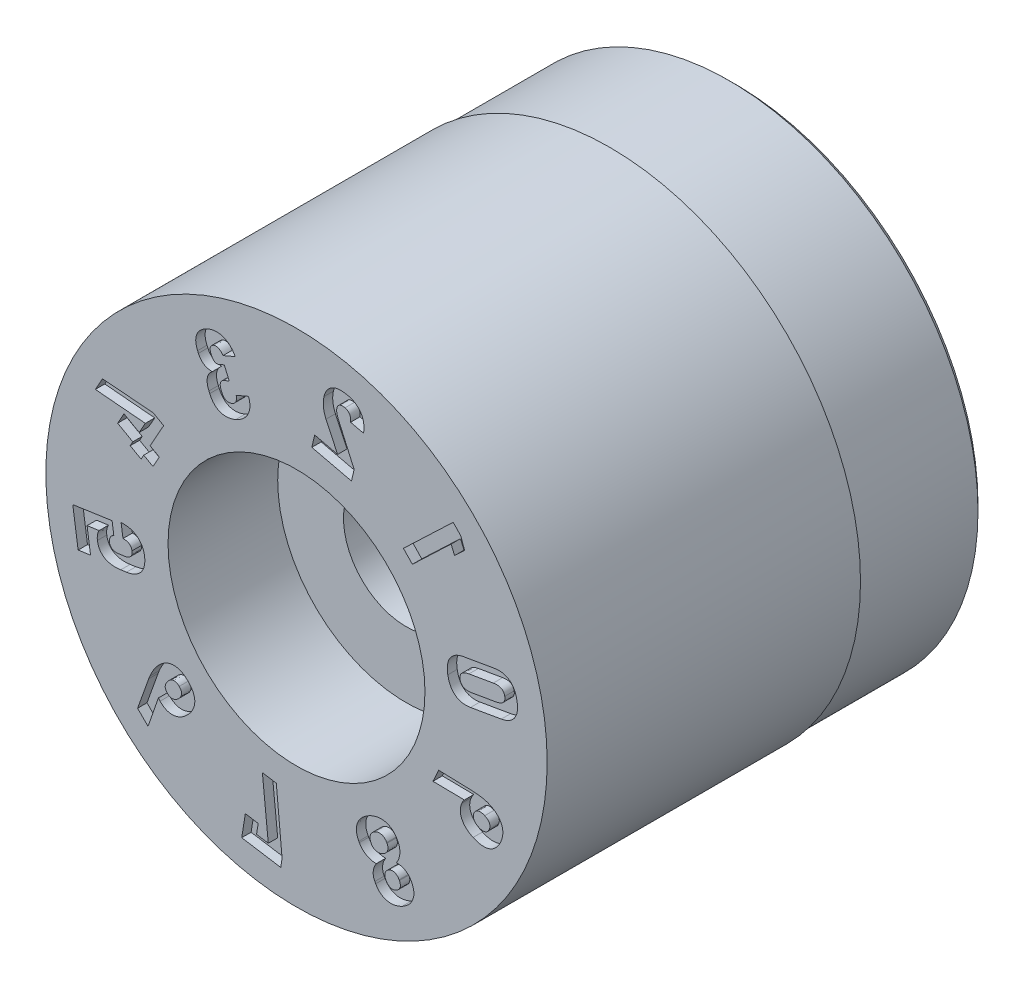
SolidWorks part; units mm, degrees
ref_plane "Front Plane" through (0, 0, 0) normal (0, 0, 1) x (1, 0, 0)
ref_plane "Top Plane" through (0, 0, 0) normal (0, 1, 0) x (1, 0, 0)
ref_plane "Right Plane" through (0, 0, 0) normal (1, 0, 0) x (0, 0, -1)
sketch "Sketch1" plane through (0, 0, 0) normal (1, 0, 0) x (0, 0, -1)
  line L2 (0, 8) -> (0, 4.1)
  line L3 (13.75, 8) -> (0, 8)
  line L4 (-3.7979, 0) -> (49996.2021, 0) construction
  line L8 (14, 2) -> (3.5, 2)
  line L9 (3.5, 4.1) -> (3.5, 2)
  line L10 (3.5, 4.1) -> (0, 4.1)
  line L12 (14, 2) -> (14, 7.75)
  line L16 (14, 7.75) -> (13.75, 8)
  dimension "D1" = 14
  dimension "D2" = 45
  dimension "D3" = 0.25
  dimension "D4" = 16
  dimension "D5" = 8.2
  dimension "D6" = 3.5
  dimension "D7" = 4
revolve "Revolve1" add sketch "Sketch1" angle 360 about L4
sketch "Sketch4" plane through (0, 0, 0) normal (1, 0, 0) x (0, 0, -1)
  line L0 (0, 0) -> (50000, 0) construction
  line L1 (14, -7.75) -> (14, 7.75) construction
  line L2 (10, 8.935) -> (14, 8.935)
  line L3 (10, 8.935) -> (10, 7.935)
  line L4 (10, 7.935) -> (14, 7.935)
  line L5 (14, 8.935) -> (14, 7.935)
  line L6 (13.75, 8) -> (0, 8) construction
  line L9 (0, 8.8) -> (0, -8.8) construction
  dimension "D1" = 1
  dimension "D2" = 0.065
  dimension "D3" = 10
revolve "Cut-Revolve1" cut sketch "Sketch4" angle 360 about L0
sketch "Sketch6" plane through (0, 0, 0) normal (0, 0, 1) x (1, 0, 0)
  line L0 (5.5542, 0.2955) -> (6.5363, 0.4655)
  line L1 (6.3127, 1.758) -> (5.3306, 1.588)
  line L2 (5.5052, 1.199) -> (6.2794, 1.3326)
  line L3 (6.3618, 0.854) -> (5.5877, 0.7204)
  line L4 (3.4124, 3.6235) -> (3.6977, 3.3237)
  line L5 (3.6977, 3.3237) -> (4.9346, 4.5019)
  line L6 (4.9346, 4.5019) -> (5.0458, 4.2393)
  line L7 (5.0458, 4.2393) -> (5.3635, 4.5421)
  line L8 (5.3635, 4.5421) -> (5.2444, 4.8814)
  line L9 (5.2444, 4.8814) -> (5.001, 5.137)
  line L10 (5.001, 5.137) -> (3.4124, 3.6235)
  line L11 (1.8398, 5.0165) -> (1.3333, 6.1553)
  line L12 (1.29, 6.4407) -> (1.2908, 6.4433)
  line L13 (1.7261, 6.2661) -> (1.7259, 6.2647)
  line L14 (1.7259, 6.2647) -> (2.1393, 6.1671)
  line L15 (2.1393, 6.1671) -> (2.1395, 6.1686)
  line L16 (0.8786, 6.5533) -> (0.8782, 6.5515)
  line L17 (0.9418, 5.9571) -> (1.3116, 5.1681)
  line L18 (1.3116, 5.1681) -> (0.5802, 5.3405)
  line L19 (0.5802, 5.3405) -> (0.4886, 4.9521)
  line L20 (0.4886, 4.9521) -> (1.7539, 4.6535)
  line L21 (1.7539, 4.6535) -> (1.8398, 5.0165)
  line L22 (-1.5333, 5.3519) -> (-1.9256, 5.1828)
  line L23 (-2.3792, 5.0286) -> (-2.3996, 5.0756)
  line L24 (-2.3182, 5.3954) -> (-2.1481, 5.469)
  line L25 (-2.1481, 5.469) -> (-2.3059, 5.8346)
  line L26 (-2.3059, 5.8346) -> (-2.476, 5.761)
  line L27 (-2.7166, 5.9039) -> (-2.7316, 5.939)
  line L28 (-2.3462, 6.0707) -> (-1.9551, 6.2391)
  line L29 (-3.1565, 5.8021) -> (-3.1304, 5.741)
  line L30 (-2.7943, 4.8707) -> (-2.7682, 4.8096)
  line L31 (-4.571, 3.3742) -> (-6.1899, 3.5076)
  line L32 (-6.1899, 3.5076) -> (-6.4194, 3.0994)
  line L33 (-6.4194, 3.0994) -> (-4.8252, 2.9593)
  line L34 (-4.8252, 2.9593) -> (-5.0211, 2.6104)
  line L35 (-5.308, 2.0993) -> (-4.9604, 1.9038)
  line L36 (-4.9604, 1.9038) -> (-4.876, 2.0542)
  line L37 (-4.2394, 3.1878) -> (-4.571, 3.3742)
  line L38 (-5.5057, 2.8825) -> (-5.7084, 2.5216)
  line L39 (-5.7084, 2.5216) -> (-5.2237, 2.2495)
  line L40 (-4.5808, 1.8885) -> (-4.3782, 2.2494)
  line L41 (-4.3782, 2.2494) -> (-4.6733, 2.4151)
  line L42 (-5.5963, -0.1705) -> (-5.5982, -0.1706)
  line L43 (-5.5982, -0.1706) -> (-5.5385, -0.5815)
  line L44 (-5.5385, -0.5815) -> (-5.5366, -0.5814)
  line L45 (-5.4859, -1.0436) -> (-5.6688, -1.0705)
  line L46 (-5.8301, -0.6456) -> (-5.8863, -0.2618)
  line L47 (-5.8863, -0.2618) -> (-7.1402, -0.4449)
  line L48 (-7.1402, -0.4449) -> (-6.9693, -1.6158)
  line L49 (-6.9693, -1.6158) -> (-6.5734, -1.5578)
  line L50 (-6.5734, -1.5578) -> (-6.6841, -0.7976)
  line L51 (-6.6841, -0.7976) -> (-6.2989, -0.7414)
  line L52 (-5.609, -1.4818) -> (-5.4261, -1.4549)
  line L53 (-4.39, -3.5025) -> (-4.3913, -3.5038)
  line L54 (-4.716, -4.0466) -> (-5.0719, -5.0388)
  line L55 (-5.0719, -5.0388) -> (-4.7385, -5.372)
  line L56 (-4.7385, -5.372) -> (-4.4072, -4.4216)
  line L58 (-3.4799, -4.4248) -> (-3.4786, -4.4235)
  line L59 (-3.7555, -4.1103) -> (-3.7568, -4.1116)
  line L60 (-4.0818, -3.7842) -> (-4.0809, -3.7833)
  line L61 (-0.4596, -6.8815) -> (-0.6441, -4.8972)
  line L62 (-0.6441, -4.8972) -> (-1.0896, -4.8259)
  line L63 (-1.0896, -4.8259) -> (-0.9003, -6.6854)
  line L64 (-0.9003, -6.6854) -> (-1.2749, -6.6254)
  line L65 (-1.2749, -6.6254) -> (-1.2226, -6.2973)
  line L66 (-1.2226, -6.2973) -> (-1.6332, -6.2317)
  line L67 (-1.6332, -6.2317) -> (-1.7486, -6.9557)
  line L68 (-1.7486, -6.9557) -> (-0.503, -7.1546)
  line L69 (-0.503, -7.1546) -> (-0.4596, -6.8815)
  line L70 (1.9882, -5.1834) -> (2.0053, -5.2152)
  line L71 (2.4996, -6.04) -> (2.5267, -6.0908)
  line L72 (3.6739, -5.4748) -> (3.6468, -5.424)
  line L73 (3.2325, -4.5565) -> (3.2154, -4.5247)
  line L74 (2.8789, -4.7738) -> (2.8888, -4.7922)
  line L75 (2.3907, -5.0578) -> (2.3799, -5.0383)
  line L76 (3.2744, -5.6056) -> (3.2842, -5.624)
  line L77 (2.8655, -5.8471) -> (2.855, -5.8272)
  line L79 (5.6352, -3.2556) -> (5.6364, -3.2563)
  line L80 (6.1605, -2.0849) -> (6.1589, -2.0845)
  line L81 (5.5532, -1.9782) -> (4.536, -1.9464)
  line L82 (4.536, -1.9464) -> (4.3553, -2.3445)
  line L83 (4.3553, -2.3445) -> (5.359, -2.3585)
  line L84 (6.0058, -2.4686) -> (6.0077, -2.4693)
  line L85 (5.8169, -2.8846) -> (5.8157, -2.8838)
  line L86 (-5.0211, 2.6104) -> (-5.5057, 2.8825)
  line L87 (-4.6733, 2.4151) -> (-4.2394, 3.1878)
  line L88 (-4.876, 2.0542) -> (-4.5808, 1.8885)
  line L89 (-5.2237, 2.2495) -> (-5.308, 2.0993)
  spline S0 degree 3 poles (4.8291, 0.8358) (4.8382, 0.7861) (4.8543, 0.714) (4.8875, 0.6241) (4.9167, 0.5646) (4.949, 0.5101) (4.9867, 0.4617) (5.0283, 0.4186) (5.0742, 0.3815) (5.1237, 0.3501) (5.1763, 0.3245) (5.2321, 0.305) (5.2909, 0.2914) (5.3526, 0.2834) (5.441, 0.2804) (5.5086, 0.2878) (5.5542, 0.2955) knots 0 0 0 0 0.147217 0.214712 0.278663 0.339975 0.399046 0.456919 0.51397 0.570756 0.627411 0.684057 0.742633 0.802806 0.865145 1 1 1 1
  spline S1 degree 3 poles (6.5363, 0.4655) (6.5824, 0.4729) (6.6486, 0.4901) (6.732, 0.5219) (6.7875, 0.5506) (6.8386, 0.583) (6.8843, 0.6204) (6.925, 0.6625) (6.961, 0.7086) (6.9911, 0.7593) (7.0157, 0.8136) (7.0347, 0.8717) (7.0474, 0.9338) (7.0533, 0.9996) (7.0557, 1.0951) (7.0469, 1.1683) (7.0382, 1.2178) knots 0 0 0 0 0.135673 0.198806 0.259377 0.317444 0.374709 0.430962 0.487709 0.544607 0.602164 0.661103 0.722235 0.786287 0.853376 1 1 1 1
  spline S2 degree 3 poles (7.0382, 1.2178) (7.0298, 1.2675) (7.0122, 1.3391) (6.98, 1.4291) (6.9514, 1.4888) (6.9188, 1.5431) (6.8817, 1.5918) (6.8405, 1.635) (6.795, 1.6722) (6.7461, 1.704) (6.6935, 1.7292) (6.6381, 1.7493) (6.579, 1.7628) (6.5169, 1.7706) (6.4274, 1.7729) (6.3589, 1.7666) (6.3127, 1.758) knots 0 0 0 0 0.146552 0.213952 0.277771 0.338999 0.397857 0.455472 0.512222 0.568665 0.624628 0.681472 0.739969 0.800447 0.86351 1 1 1 1
  spline S3 degree 3 poles (5.3306, 1.588) (5.2846, 1.5805) (5.2183, 1.5633) (5.135, 1.5316) (5.0794, 1.5029) (5.0283, 1.4705) (4.9826, 1.4331) (4.9419, 1.3909) (4.9059, 1.3449) (4.8758, 1.2942) (4.8512, 1.2398) (4.8323, 1.1815) (4.8205, 1.1194) (4.8132, 1.0537) (4.8126, 0.9583) (4.8202, 0.8852) (4.8291, 0.8358) knots 0 0 0 0 0.135708 0.198857 0.259443 0.317526 0.374806 0.431073 0.487835 0.544747 0.60232 0.661617 0.722541 0.786404 0.853765 1 1 1 1
  spline S4 degree 3 poles (5.2216, 0.9036) (5.2188, 0.9228) (5.2153, 0.9514) (5.2186, 0.9884) (5.2233, 1.014) (5.2314, 1.0379) (5.2428, 1.0601) (5.2563, 1.0811) (5.2799, 1.1068) (5.3168, 1.1351) (5.3926, 1.1747) (5.4587, 1.1908) (5.5052, 1.199) knots 0 0 0 0 0.125469 0.183502 0.238196 0.292202 0.345199 0.39803 0.452614 0.568042 0.695193 1 1 1 1
  spline S5 degree 3 poles (6.2794, 1.3326) (6.326, 1.3401) (6.3937, 1.3477) (6.4784, 1.336) (6.5226, 1.3218) (6.5534, 1.3057) (6.5734, 1.2906) (6.5917, 1.2737) (6.6074, 1.2538) (6.6205, 1.2312) (6.6361, 1.1974) (6.643, 1.1695) (6.6462, 1.1502) knots 0 0 0 0 0.304769 0.431914 0.546788 0.601175 0.654439 0.70726 0.761007 0.816749 0.874563 1 1 1 1
  spline S6 degree 3 poles (6.6462, 1.1502) (6.649, 1.131) (6.6525, 1.1024) (6.6492, 1.0652) (6.6444, 1.0395) (6.6358, 1.0157) (6.6246, 0.9934) (6.6106, 0.9725) (6.5871, 0.9467) (6.5504, 0.9179) (6.4744, 0.8784) (6.4084, 0.8622) (6.3618, 0.854) knots 0 0 0 0 0.125263 0.1832 0.239119 0.292289 0.345198 0.398713 0.453207 0.568753 0.695695 1 1 1 1
  spline S7 degree 3 poles (5.5877, 0.7204) (5.5412, 0.7127) (5.4737, 0.7057) (5.389, 0.717) (5.3449, 0.7318) (5.314, 0.748) (5.2939, 0.7628) (5.2761, 0.7802) (5.2603, 0.8) (5.2473, 0.8226) (5.2317, 0.8564) (5.2248, 0.8843) (5.2216, 0.9036) knots 0 0 0 0 0.304087 0.431327 0.546883 0.601309 0.654613 0.707043 0.76083 0.816614 0.87447 1 1 1 1
  spline S8 degree 3 poles (1.3333, 6.1553) (1.3113, 6.2033) (1.292, 6.2662) (1.2829, 6.3424) (1.2819, 6.3874) (1.2853, 6.42) (1.29, 6.4407) knots 0 0 0 0 0.539922 0.665878 0.783523 1 1 1 1
  spline S9 degree 3 poles (1.2908, 6.4433) (1.2971, 6.4692) (1.3113, 6.507) (1.3468, 6.5449) (1.378, 6.5655) (1.4146, 6.5786) (1.4721, 6.5877) (1.5176, 6.5804) (1.5481, 6.5737) knots 0 0 0 0 0.24666 0.358009 0.470272 0.586522 0.711155 1 1 1 1
  spline S10 degree 3 poles (1.5481, 6.5737) (1.579, 6.5668) (1.6226, 6.5483) (1.6696, 6.5077) (1.6962, 6.4702) (1.7156, 6.4268) (1.7317, 6.3585) (1.7307, 6.3035) (1.7261, 6.2661) knots 0 0 0 0 0.240293 0.353106 0.46857 0.587391 0.712468 1 1 1 1
  spline S11 degree 3 poles (2.1395, 6.1686) (2.1505, 6.2324) (2.1574, 6.3271) (2.1458, 6.4502) (2.1263, 6.5348) (2.0973, 6.6138) (2.0583, 6.6861) (2.0102, 6.7517) (1.9528, 6.8101) (1.8866, 6.8606) (1.7862, 6.9193) (1.7016, 6.9473) (1.6433, 6.9613) knots 0 0 0 0 0.18586 0.271097 0.354001 0.434451 0.512068 0.589213 0.667237 0.746341 0.827602 1 1 1 1
  spline S12 degree 3 poles (1.6433, 6.9613) (1.5812, 6.9762) (1.4889, 6.9901) (1.3685, 6.9891) (1.2867, 6.9781) (1.2107, 6.958) (1.1412, 6.9275) (1.0784, 6.8874) (1.0227, 6.8376) (0.9743, 6.7791) (0.9187, 6.6866) (0.8917, 6.608) (0.8786, 6.5533) knots 0 0 0 0 0.194839 0.283119 0.366442 0.445864 0.522265 0.597081 0.672165 0.748905 0.828025 1 1 1 1
  spline S13 degree 3 poles (0.8782, 6.5515) (0.8664, 6.5029) (0.8562, 6.4281) (0.8544, 6.327) (0.8599, 6.2503) (0.8713, 6.1741) (0.8938, 6.0747) (0.9208, 6.0032) (0.9418, 5.9571) knots 0 0 0 0 0.246312 0.370558 0.498065 0.625011 0.750111 1 1 1 1
  spline S14 degree 3 poles (-1.9364, 4.5089) (-1.8781, 4.5334) (-1.7967, 4.5789) (-1.7001, 4.6532) (-1.6385, 4.7144) (-1.5867, 4.7809) (-1.5446, 4.8521) (-1.5139, 4.9282) (-1.4933, 5.0083) (-1.4844, 5.0917) (-1.49, 5.2085) (-1.512, 5.2953) (-1.5333, 5.3519) knots 0 0 0 0 0.181401 0.266539 0.349449 0.430114 0.508126 0.586429 0.665043 0.744996 0.826374 1 1 1 1
  spline S15 degree 3 poles (-1.9256, 5.1828) (-1.9196, 5.1622) (-1.9147, 5.131) (-1.913, 5.0899) (-1.9161, 5.0612) (-1.9226, 5.0339) (-1.9326, 5.0085) (-1.9449, 4.9845) (-1.9609, 4.9626) (-1.9798, 4.9425) (-2.0097, 4.9184) (-2.035, 4.9034) (-2.0536, 4.896) knots 0 0 0 0 0.185865 0.271783 0.354772 0.435257 0.513511 0.590038 0.668281 0.74713 0.827936 1 1 1 1
  spline S16 degree 3 poles (-2.0536, 4.896) (-2.0859, 4.8819) (-2.136, 4.8673) (-2.2028, 4.8699) (-2.2474, 4.8827) (-2.2885, 4.905) (-2.3384, 4.9505) (-2.3649, 4.9959) (-2.3792, 5.0286) knots 0 0 0 0 0.266348 0.383344 0.497307 0.612195 0.731219 1 1 1 1
  spline S17 degree 3 poles (-2.3996, 5.0756) (-2.414, 5.1099) (-2.4314, 5.161) (-2.4356, 5.2292) (-2.4297, 5.2734) (-2.4153, 5.3134) (-2.3821, 5.3601) (-2.3453, 5.3843) (-2.3182, 5.3954) knots 0 0 0 0 0.300133 0.427472 0.545362 0.656146 0.76528 1 1 1 1
  spline S18 degree 3 poles (-2.476, 5.761) (-2.498, 5.7516) (-2.5337, 5.7435) (-2.5804, 5.7521) (-2.6129, 5.7673) (-2.6429, 5.7908) (-2.6827, 5.8337) (-2.7036, 5.875) (-2.7166, 5.9039) knots 0 0 0 0 0.228705 0.33556 0.446598 0.566693 0.696338 1 1 1 1
  spline S19 degree 3 poles (-2.7316, 5.939) (-2.7433, 5.9666) (-2.7572, 6.0085) (-2.7581, 6.0644) (-2.7512, 6.1011) (-2.7371, 6.1345) (-2.7061, 6.174) (-2.6733, 6.1948) (-2.6493, 6.2049) knots 0 0 0 0 0.286802 0.411384 0.527644 0.639553 0.752359 1 1 1 1
  spline S20 degree 3 poles (-2.6493, 6.2049) (-2.6327, 6.2118) (-2.6067, 6.2194) (-2.5709, 6.2217) (-2.544, 6.2196) (-2.5171, 6.2135) (-2.4906, 6.2038) (-2.4645, 6.1902) (-2.4388, 6.1733) (-2.414, 6.1528) (-2.381, 6.1201) (-2.3601, 6.0908) (-2.3462, 6.0707) knots 0 0 0 0 0.149222 0.221968 0.296835 0.371824 0.450058 0.530027 0.61556 0.703724 0.796659 1 1 1 1
  spline S21 degree 3 poles (-1.9551, 6.2391) (-1.9851, 6.2952) (-2.0375, 6.3731) (-2.1222, 6.4612) (-2.1894, 6.5158) (-2.2615, 6.5594) (-2.3362, 6.5934) (-2.4144, 6.6159) (-2.4948, 6.6273) (-2.5769, 6.6292) (-2.6882, 6.6153) (-2.7698, 6.5912) (-2.822, 6.5679) knots 0 0 0 0 0.185508 0.27192 0.355883 0.437458 0.516877 0.594873 0.673735 0.753358 0.833517 1 1 1 1
  spline S22 degree 3 poles (-2.822, 6.5679) (-2.8645, 6.5502) (-2.924, 6.5189) (-2.9973, 6.4711) (-3.0446, 6.4328) (-3.0864, 6.392) (-3.1229, 6.3485) (-3.1529, 6.3019) (-3.1781, 6.2534) (-3.1971, 6.2025) (-3.2095, 6.1497) (-3.2163, 6.0954) (-3.2169, 6.0394) (-3.211, 5.982) (-3.1946, 5.9013) (-3.1734, 5.8417) (-3.1565, 5.8021) knots 0 0 0 0 0.145061 0.211857 0.275608 0.336951 0.396012 0.454001 0.511451 0.568288 0.624902 0.682242 0.740636 0.80114 0.864066 1 1 1 1
  spline S23 degree 3 poles (-3.1304, 5.741) (-3.1114, 5.6968) (-3.075, 5.6349) (-3.0098, 5.5671) (-2.955, 5.526) (-2.8947, 5.4936) (-2.8055, 5.4639) (-2.7341, 5.457) (-2.686, 5.4585) knots 0 0 0 0 0.256655 0.378901 0.500184 0.62101 0.743149 1 1 1 1
  spline S24 degree 3 poles (-2.686, 5.4585) (-2.7076, 5.4436) (-2.7364, 5.4174) (-2.7708, 5.3792) (-2.7919, 5.3484) (-2.8109, 5.3164) (-2.8254, 5.2821) (-2.8378, 5.2464) (-2.846, 5.2088) (-2.8511, 5.1699) (-2.8538, 5.13) (-2.852, 5.089) (-2.8473, 5.047) (-2.8396, 5.004) (-2.8231, 4.9446) (-2.8076, 4.9) (-2.7943, 4.8707) knots 0 0 0 0 0.120558 0.179135 0.236211 0.292841 0.349917 0.407543 0.466837 0.527043 0.588152 0.650977 0.715968 0.782503 0.852077 1 1 1 1
  spline S25 degree 3 poles (-2.7682, 4.8096) (-2.745, 4.7545) (-2.7025, 4.6779) (-2.63, 4.5905) (-2.5708, 4.5376) (-2.5063, 4.4952) (-2.437, 4.4632) (-2.3626, 4.4431) (-2.2838, 4.4342) (-2.201, 4.4355) (-2.0825, 4.4541) (-1.9946, 4.4837) (-1.9364, 4.5089) knots 0 0 0 0 0.17815 0.259397 0.337906 0.414 0.488874 0.564675 0.643063 0.724728 0.810804 1 1 1 1
  spline S26 degree 3 poles (-4.8514, -0.7137) (-4.8589, -0.6575) (-4.8809, -0.576) (-4.9283, -0.4758) (-4.9731, -0.4085) (-5.0259, -0.348) (-5.0871, -0.2956) (-5.1562, -0.2512) (-5.2328, -0.2157) (-5.3157, -0.1891) (-5.4372, -0.1663) (-5.5321, -0.1654) (-5.5963, -0.1705) knots 0 0 0 0 0.16546 0.244569 0.323028 0.400794 0.478555 0.557836 0.639786 0.724566 0.811668 1 1 1 1
  spline S27 degree 3 poles (-5.5366, -0.5814) (-5.4999, -0.5803) (-5.4459, -0.5822) (-5.3803, -0.6035) (-5.339, -0.6258) (-5.3044, -0.655) (-5.267, -0.703) (-5.254, -0.7482) (-5.2491, -0.7783) knots 0 0 0 0 0.286363 0.412043 0.532487 0.647222 0.761276 1 1 1 1
  spline S28 degree 3 poles (-5.2491, -0.7783) (-5.244, -0.8106) (-5.2442, -0.8599) (-5.2674, -0.9192) (-5.2942, -0.957) (-5.33, -0.9891) (-5.3925, -1.0246) (-5.4475, -1.038) (-5.4859, -1.0436) knots 0 0 0 0 0.244128 0.355732 0.468897 0.585718 0.710251 1 1 1 1
  spline S29 degree 3 poles (-5.6688, -1.0705) (-5.7072, -1.0761) (-5.763, -1.0786) (-5.8329, -1.0659) (-5.8755, -1.0478) (-5.911, -1.0228) (-5.9487, -0.9787) (-5.9626, -0.9362) (-5.9669, -0.9072) knots 0 0 0 0 0.303244 0.432822 0.551411 0.662147 0.769354 1 1 1 1
  spline S30 degree 3 poles (-5.9669, -0.9072) (-5.9711, -0.8796) (-5.972, -0.8382) (-5.9599, -0.7855) (-5.9449, -0.7496) (-5.9242, -0.717) (-5.8882, -0.6785) (-5.8547, -0.6565) (-5.8301, -0.6456) knots 0 0 0 0 0.263061 0.384723 0.506711 0.627451 0.74668 1 1 1 1
  spline S31 degree 3 poles (-6.2989, -0.7414) (-6.3122, -0.7602) (-6.3287, -0.7922) (-6.3442, -0.8392) (-6.3606, -0.9188) (-6.3627, -0.988) (-6.3546, -1.0423) knots 0 0 0 0 0.220581 0.343194 0.47421 1 1 1 1
  spline S32 degree 3 poles (-6.3546, -1.0423) (-6.3469, -1.0951) (-6.3273, -1.1718) (-6.2791, -1.2627) (-6.2357, -1.3218) (-6.1835, -1.3729) (-6.1228, -1.4151) (-6.0545, -1.4489) (-5.9784, -1.4732) (-5.8954, -1.4898) (-5.771, -1.4982) (-5.6746, -1.492) (-5.609, -1.4818) knots 0 0 0 0 0.163639 0.239143 0.313484 0.387163 0.461716 0.538709 0.619508 0.705416 0.79704 1 1 1 1
  spline S33 degree 3 poles (-5.4261, -1.4549) (-5.3606, -1.4449) (-5.2654, -1.4241) (-5.1504, -1.3734) (-5.0758, -1.3288) (-5.0111, -1.2758) (-4.9554, -1.2161) (-4.9111, -1.148) (-4.8772, -1.0731) (-4.8533, -0.9917) (-4.8372, -0.871) (-4.8416, -0.7771) (-4.8514, -0.7137) knots 0 0 0 0 0.186821 0.272018 0.352817 0.430697 0.506513 0.58175 0.658355 0.737107 0.81954 1 1 1 1
  spline S34 degree 3 poles (-3.4602, -3.4869) (-3.5046, -3.4417) (-3.5765, -3.3823) (-3.6823, -3.3236) (-3.7615, -3.2942) (-3.8412, -3.2757) (-3.9218, -3.2712) (-4.0024, -3.2786) (-4.0828, -3.2989) (-4.1623, -3.3318) (-4.2702, -3.3937) (-4.3437, -3.4558) (-4.39, -3.5025) knots 0 0 0 0 0.179949 0.262715 0.342044 0.419012 0.494231 0.570034 0.647805 0.728853 0.813187 1 1 1 1
  spline S35 degree 3 poles (-4.3913, -3.5038) (-4.4204, -3.5334) (-4.4624, -3.5806) (-4.5133, -3.6492) (-4.5906, -3.7639) (-4.6441, -3.868) (-4.6808, -3.9547) knots 0 0 0 0 0.230544 0.351201 0.475829 1 1 1 1
  spline S36 degree 3 poles (-4.6808, -3.9547) (-4.6874, -3.9701) (-4.7001, -4.0004) (-4.7111, -4.0314) (-4.716, -4.0466) knots 0 0 0 0 0.512075 1 1 1 1
  spline S37 degree 3 poles (-4.4072, -4.4216) (-4.3922, -4.4442) (-4.3746, -4.4652) (-4.3554, -4.4843) knots 0.757795 0.757795 0.757795 0.757795 1 1 1 1
  spline S38 degree 3 poles (-4.3554, -4.4843) (-4.3158, -4.5255) (-4.2496, -4.5768) (-4.1536, -4.6281) (-4.0807, -4.6521) (-4.0064, -4.6647) (-3.931, -4.6656) (-3.855, -4.6535) (-3.7784, -4.6309) (-3.702, -4.596) (-3.5972, -4.5329) (-3.5259, -4.4703) (-3.4799, -4.4248) knots 0 0 0 0 0.171701 0.250399 0.326814 0.40168 0.476384 0.552815 0.632553 0.716348 0.804943 1 1 1 1
  spline S39 degree 3 poles (-3.4786, -4.4235) (-3.4316, -4.3766) (-3.3686, -4.3024) (-3.3064, -4.1933) (-3.2727, -4.1131) (-3.2523, -4.0319) (-3.2434, -3.9507) (-3.2483, -3.8699) (-3.2659, -3.7897) (-3.296, -3.7106) (-3.3543, -3.6038) (-3.4151, -3.5321) (-3.4602, -3.4869) knots 0 0 0 0 0.187135 0.271987 0.35314 0.431352 0.507131 0.582184 0.658395 0.737527 0.819842 1 1 1 1
  spline S40 degree 3 poles (-3.7442, -3.7713) (-3.72, -3.7944) (-3.6905, -3.834) (-3.6699, -3.8941) (-3.6669, -3.9387) (-3.6735, -3.9834) (-3.6985, -4.0447) (-3.7306, -4.0852) (-3.7555, -4.1103) knots 0 0 0 0 0.260142 0.376268 0.489282 0.604491 0.724472 1 1 1 1
  spline S41 degree 3 poles (-3.7568, -4.1116) (-3.7854, -4.1406) (-3.8312, -4.178) (-3.8991, -4.2097) (-3.9475, -4.2206) (-3.9948, -4.2199) (-4.0578, -4.2035) (-4.0986, -4.1736) (-4.1222, -4.1497) knots 0 0 0 0 0.293565 0.419713 0.536388 0.647203 0.757306 1 1 1 1
  spline S42 degree 3 poles (-4.1222, -4.1497) (-4.1458, -4.1266) (-4.1746, -4.086) (-4.1909, -4.0234) (-4.1905, -3.9758) (-4.1797, -3.927) (-4.1473, -3.8591) (-4.1113, -3.8125) (-4.0818, -3.7842) knots 0 0 0 0 0.238902 0.348908 0.460953 0.579093 0.705882 1 1 1 1
  spline S43 degree 3 poles (-4.0809, -3.7833) (-4.0557, -3.7585) (-4.0156, -3.7254) (-3.9539, -3.7018) (-3.9095, -3.6952) (-3.8654, -3.6985) (-3.8061, -3.7188) (-3.7672, -3.7479) (-3.7442, -3.7713) knots 0 0 0 0 0.278622 0.398676 0.513434 0.627401 0.742189 1 1 1 1
  spline S44 degree 3 poles (2.313, -4.3163) (2.2552, -4.3475) (2.1744, -4.4005) (2.082, -4.4859) (2.0257, -4.5542) (1.979, -4.6258) (1.9448, -4.7014) (1.9214, -4.7794) (1.9104, -4.8599) (1.9115, -4.9414) (1.9282, -5.0528) (1.9615, -5.1324) (1.9882, -5.1834) knots 0 0 0 0 0.189078 0.276649 0.361473 0.443244 0.522124 0.599573 0.676944 0.755001 0.83359 1 1 1 1
  spline S45 degree 3 poles (2.0053, -5.2152) (2.0304, -5.2631) (2.0793, -5.3288) (2.1612, -5.4015) (2.2311, -5.4468) (2.3059, -5.4834) (2.4108, -5.5177) (2.4934, -5.5258) (2.5482, -5.5234) knots 0 0 0 0 0.246328 0.37033 0.497932 0.625314 0.749975 1 1 1 1
  spline S46 degree 3 poles (2.5482, -5.5234) (2.5209, -5.5615) (2.4864, -5.6234) (2.4599, -5.7132) (2.4487, -5.7818) (2.446, -5.8505) (2.4568, -5.9389) (2.4781, -6.0019) (2.4996, -6.04) knots 0 0 0 0 0.25765 0.384612 0.512448 0.63886 0.760555 1 1 1 1
  spline S47 degree 3 poles (2.5267, -6.0908) (2.5524, -6.1387) (2.5982, -6.2056) (2.6763, -6.2774) (2.7398, -6.3208) (2.8086, -6.3538) (2.8815, -6.3773) (2.9584, -6.3895) (3.0386, -6.3914) (3.121, -6.3822) (3.2358, -6.3559) (3.3189, -6.3198) (3.3731, -6.2911) knots 0 0 0 0 0.166896 0.245775 0.324141 0.401845 0.479016 0.557976 0.639727 0.724334 0.811528 1 1 1 1
  spline S48 degree 3 poles (3.3731, -6.2911) (3.4275, -6.2628) (3.5023, -6.2121) (3.5888, -6.1323) (3.6416, -6.0681) (3.6842, -6.0001) (3.7163, -5.9292) (3.7374, -5.8555) (3.7477, -5.7798) (3.747, -5.7027) (3.7293, -5.598) (3.6999, -5.5225) (3.6739, -5.4748) knots 0 0 0 0 0.187786 0.275345 0.360085 0.44166 0.520588 0.597955 0.675813 0.753956 0.833373 1 1 1 1
  spline S49 degree 3 poles (3.6468, -5.424) (3.6256, -5.385) (3.5856, -5.3306) (3.5161, -5.2733) (3.4572, -5.2377) (3.3934, -5.2097) (3.3033, -5.1841) (3.2327, -5.179) (3.1858, -5.1814) knots 0 0 0 0 0.242339 0.363857 0.489665 0.617294 0.743277 1 1 1 1
  spline S50 degree 3 poles (3.1858, -5.1814) (3.2185, -5.1367) (3.2563, -5.0623) (3.2876, -4.9556) (3.299, -4.8726) (3.3002, -4.7892) (3.2857, -4.681) (3.2582, -4.604) (3.2325, -4.5565) knots 0 0 0 0 0.251609 0.376385 0.504475 0.631826 0.754747 1 1 1 1
  spline S51 degree 3 poles (3.2154, -4.5247) (3.1885, -4.4736) (3.1388, -4.4033) (3.0563, -4.3268) (2.9888, -4.2808) (2.9156, -4.2458) (2.8378, -4.2219) (2.7559, -4.2091) (2.6704, -4.2078) (2.5823, -4.2175) (2.4598, -4.2474) (2.3707, -4.285) (2.313, -4.3163) knots 0 0 0 0 0.166231 0.245085 0.322951 0.400273 0.477859 0.556396 0.63802 0.723225 0.810881 1 1 1 1
  spline S52 degree 3 poles (2.5017, -4.6676) (2.5246, -4.6546) (2.5608, -4.6404) (2.6107, -4.6294) (2.6473, -4.627) (2.6831, -4.6291) (2.7176, -4.6361) (2.7503, -4.6483) (2.7816, -4.6644) (2.81, -4.6859) (2.8461, -4.7197) (2.8668, -4.7515) (2.8789, -4.7738) knots 0 0 0 0 0.178896 0.263036 0.346434 0.427545 0.506484 0.584924 0.664664 0.745109 0.826702 1 1 1 1
  spline S53 degree 3 poles (2.8888, -4.7922) (2.9, -4.8129) (2.9127, -4.8453) (2.9202, -4.8904) (2.9203, -4.9234) (2.9155, -4.956) (2.9058, -4.9875) (2.8921, -5.0182) (2.8735, -5.0474) (2.8509, -5.0753) (2.8133, -5.1098) (2.7809, -5.1316) (2.7574, -5.1441) knots 0 0 0 0 0.167101 0.245235 0.323267 0.400684 0.478274 0.556818 0.638596 0.723955 0.811253 1 1 1 1
  spline S54 degree 3 poles (2.7574, -5.1441) (2.7338, -5.1564) (2.6981, -5.1723) (2.6485, -5.1837) (2.6129, -5.1874) (2.5782, -5.1867) (2.545, -5.1813) (2.5131, -5.1719) (2.4833, -5.1574) (2.4559, -5.1384) (2.4215, -5.1079) (2.4018, -5.0785) (2.3907, -5.0578) knots 0 0 0 0 0.188626 0.274698 0.359644 0.44096 0.520036 0.597365 0.675328 0.753635 0.832796 1 1 1 1
  spline S55 degree 3 poles (2.3799, -5.0383) (2.3686, -5.0157) (2.3534, -4.9811) (2.3452, -4.9325) (2.3437, -4.8971) (2.3475, -4.8623) (2.3556, -4.8285) (2.369, -4.7962) (2.3874, -4.7657) (2.4095, -4.7369) (2.446, -4.7015) (2.4782, -4.6797) (2.5017, -4.6676) knots 0 0 0 0 0.173393 0.255039 0.335545 0.415041 0.493234 0.572362 0.65316 0.736124 0.819664 1 1 1 1
  spline S56 degree 3 poles (2.9474, -5.4984) (2.9671, -5.4877) (2.9978, -5.4749) (3.0406, -5.4672) (3.0717, -5.4657) (3.1022, -5.4685) (3.1316, -5.4761) (3.1598, -5.4878) (3.187, -5.5036) (3.2122, -5.5239) (3.2442, -5.556) (3.2629, -5.5853) (3.2744, -5.6056) knots 0 0 0 0 0.17326 0.255062 0.335338 0.413988 0.491171 0.568975 0.650072 0.733637 0.818703 1 1 1 1
  spline S57 degree 3 poles (3.2842, -5.624) (3.295, -5.6432) (3.3065, -5.6735) (3.3147, -5.7151) (3.3163, -5.7452) (3.3135, -5.7748) (3.3064, -5.8031) (3.2962, -5.8306) (3.2809, -5.8563) (3.2623, -5.8804) (3.2315, -5.9107) (3.2043, -5.9294) (3.1844, -5.9398) knots 0 0 0 0 0.176515 0.259001 0.339812 0.418896 0.496875 0.574483 0.653995 0.735988 0.819475 1 1 1 1
  spline S58 degree 3 poles (3.1844, -5.9398) (3.1645, -5.95) (3.1343, -5.9637) (3.092, -5.972) (3.0615, -5.9745) (3.0315, -5.9724) (3.0026, -5.9664) (2.9752, -5.9555) (2.9488, -5.9416) (2.9246, -5.923) (2.8942, -5.8933) (2.8756, -5.8665) (2.8655, -5.8471) knots 0 0 0 0 0.179667 0.262682 0.344635 0.424577 0.503105 0.580418 0.65981 0.741413 0.82435 1 1 1 1
  spline S59 degree 3 poles (2.855, -5.8272) (2.8438, -5.807) (2.8313, -5.7753) (2.8216, -5.7317) (2.8196, -5.6998) (2.8212, -5.6689) (2.8274, -5.639) (2.8376, -5.6107) (2.8517, -5.5836) (2.8699, -5.5586) (2.9004, -5.5277) (2.9274, -5.5086) (2.9474, -5.4984) knots 0 0 0 0 0.179873 0.264826 0.347177 0.428195 0.506167 0.584244 0.662816 0.743371 0.825266 1 1 1 1
  spline S60 degree 3 poles (5.359, -2.3585) (5.3577, -2.3599) (5.3466, -2.3726) (5.3162, -2.4116) (5.2937, -2.4539) (5.2804, -2.4836) knots 0.564343 0.564343 0.564343 0.564343 0.581084 0.712582 1 1 1 1
  spline S61 degree 3 poles (5.2804, -2.4836) (5.2583, -2.5312) (5.2351, -2.6058) (5.2256, -2.7076) (5.2308, -2.782) (5.2465, -2.8545) (5.2729, -2.9246) (5.3093, -2.9916) (5.3566, -3.0546) (5.4129, -3.1136) (5.5029, -3.1866) (5.5799, -3.231) (5.6352, -3.2556) knots 0 0 0 0 0.164837 0.242878 0.320261 0.39802 0.475288 0.554686 0.63665 0.722189 0.810266 1 1 1 1
  spline S62 degree 3 poles (5.6364, -3.2563) (5.6965, -3.2836) (5.7877, -3.3166) (5.9112, -3.3365) (5.9976, -3.3395) (6.0799, -3.3302) (6.1584, -3.3107) (6.2315, -3.2774) (6.3001, -3.2338) (6.3629, -3.1785) (6.441, -3.0871) (6.4876, -3.0066) (6.5132, -2.9486) knots 0 0 0 0 0.187716 0.273305 0.354392 0.432452 0.507996 0.583043 0.659456 0.737975 0.819846 1 1 1 1
  spline S63 degree 3 poles (6.5132, -2.9486) (6.5391, -2.8914) (6.5695, -2.804) (6.5864, -2.6852) (6.5857, -2.6012) (6.5728, -2.5206) (6.5486, -2.4436) (6.5118, -2.371) (6.4633, -2.3028) (6.4036, -2.2396) (6.306, -2.1601) (6.221, -2.1126) (6.1605, -2.0849) knots 0 0 0 0 0.177989 0.259864 0.338478 0.414902 0.490128 0.566171 0.644438 0.726152 0.811501 1 1 1 1
  spline S64 degree 3 poles (6.1589, -2.0845) (6.124, -2.0692) (6.0691, -2.0481) (5.9916, -2.0276) (5.9289, -2.0138) (5.8624, -2.0028) (5.7665, -1.991) (5.6926, -1.9849) (5.6422, -1.9819) knots 0 0 0 0 0.216308 0.332266 0.453296 0.580194 0.713875 1 1 1 1
  spline S65 degree 3 poles (5.6422, -1.9819) (5.6273, -1.9815) (5.5978, -1.9775) (5.568, -1.9782) (5.5532, -1.9782) knots 0 0 0 0 0.501356 1 1 1 1
  spline S66 degree 3 poles (5.6674, -2.5644) (5.681, -2.535) (5.7073, -2.4934) (5.7585, -2.4563) (5.8009, -2.4386) (5.8477, -2.4315) (5.9184, -2.4348) (5.9711, -2.4528) (6.0058, -2.4686) knots 0 0 0 0 0.245703 0.358567 0.471253 0.587905 0.711944 1 1 1 1
  spline S67 degree 3 poles (6.0077, -2.4693) (6.041, -2.4849) (6.0877, -2.5115) (6.1345, -2.5612) (6.1578, -2.6009) (6.1713, -2.6438) (6.1749, -2.7064) (6.1612, -2.7531) (6.1478, -2.7828) knots 0 0 0 0 0.28408 0.405996 0.521892 0.635123 0.748261 1 1 1 1
  spline S68 degree 3 poles (6.1478, -2.7828) (6.1339, -2.8126) (6.1081, -2.8548) (6.0576, -2.8932) (6.0161, -2.9111) (5.9705, -2.9194) (5.9016, -2.9179) (5.8506, -2.8994) (5.8169, -2.8846) knots 0 0 0 0 0.253192 0.366315 0.478781 0.595288 0.71712 1 1 1 1
  spline S69 degree 3 poles (5.8157, -2.8838) (5.7809, -2.8682) (5.7333, -2.8399) (5.6837, -2.7896) (5.6592, -2.7492) (5.6446, -2.7058) (5.6404, -2.6422) (5.6532, -2.5945) (5.6674, -2.5644) knots 0 0 0 0 0.286692 0.41017 0.526317 0.638369 0.750506 1 1 1 1
extrude "Cut-Extrude1" cut sketch "Sketch6" against normal blind 0.3
